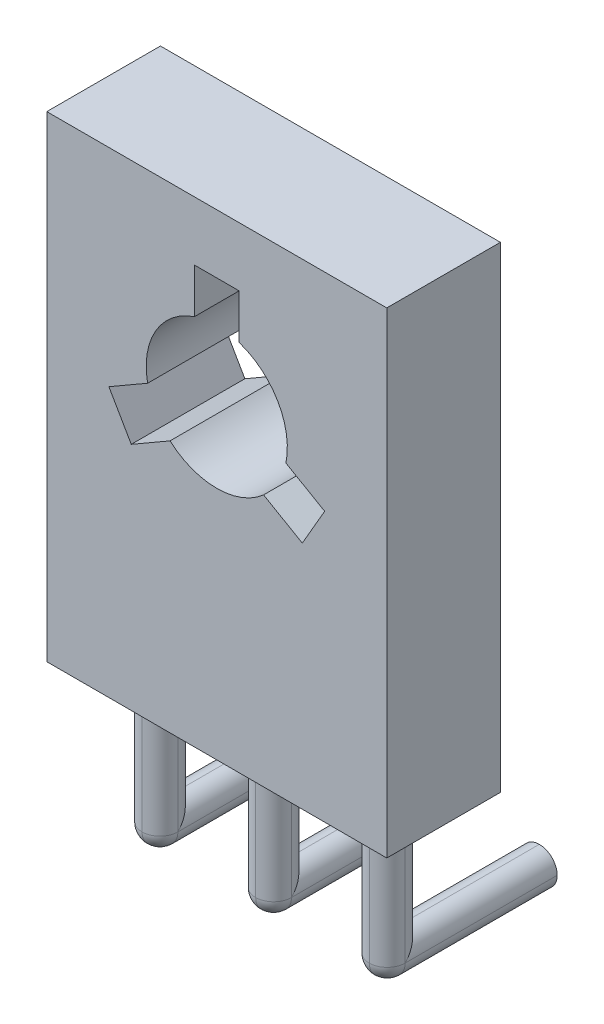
SolidWorks part; units mm, degrees
ref_plane "Face" through (0, 0, 0) normal (0, 0, 1) x (1, 0, 0)
ref_plane "Dessus" through (0, 0, 0) normal (0, 1, 0) x (1, 0, 0)
ref_plane "Droite" through (0, 0, 0) normal (1, 0, 0) x (0, 0, -1)
sketch "Esquisse1" plane through (0, 0, 0) normal (0, 0, 1) x (1, 0, 0)
  line L1 (-21.9012, 5.7776) -> (-14.3012, 5.7776)
  line L2 (-21.9012, 5.7776) -> (-21.9012, 16.4276)
  line L3 (-21.9012, 16.4276) -> (-14.3012, 16.4276)
  line L4 (-14.3012, 5.7776) -> (-14.3012, 16.4276)
  dimension "D1" = 10.65
  dimension "D2" = 7.6
extrude "Extrusion1" add sketch "Esquisse1" along normal blind 2.54
sketch "Esquisse2" plane through (0, 0, 2.54) normal (0, 0, 1) x (1, 0, 0)
  line L0 (-18.1012, 16.4276) -> (-18.1012, 5.7776) construction
  line L1 (-14.3012, 16.4276) -> (-21.9012, 16.4276) construction
  line L2 (-21.9012, 5.7776) -> (-14.3012, 5.7776) construction
  line L3 (-18.6012, 15.1075) -> (-17.6012, 15.1075)
  line L4 (-17.6012, 15.1075) -> (-17.6012, 14.1075)
  line L5 (-18.6012, 15.1075) -> (-18.6012, 14.1075)
  line L6 (-18.1012, 12.6114) -> (-21.1151, 10.8713) construction
  line L7 (-18.1012, 12.6114) -> (-15.5614, 11.145) construction
  line L8 (-20.5129, 11.7963) -> (-20.0129, 10.9303)
  line L9 (-16.1895, 10.9303) -> (-15.6895, 11.7963)
  line L10 (-20.0129, 10.9303) -> (-19.1469, 11.4303)
  line L11 (-20.5129, 11.7963) -> (-19.6469, 12.2963)
  line L12 (-16.1895, 10.9303) -> (-17.0555, 11.4303)
  line L13 (-15.6895, 11.7963) -> (-16.5555, 12.2963)
  arc A0 (-17.6012, 14.1075) -> (-16.5555, 12.2963) centre (-18.1012, 12.6114) cw
  arc A1 (-18.6012, 14.1075) -> (-19.6469, 12.2963) centre (-18.1012, 12.6114) ccw
  arc A2 (-19.1469, 11.4303) -> (-17.0555, 11.4303) centre (-18.1012, 12.6114) ccw
  dimension "D3" = 1
  dimension "D4" = 60
  dimension "D5" = 1
extrude "Enlèv. mat.-Extru.1" cut sketch "Esquisse2" against normal through all
sketch "Esquisse3" plane through (0, 5.7776, 0) normal (0, -1, 0) x (1, 0, 0)
  line L0 (-21.9012, 1.27) -> (-14.3012, 1.27) construction
  line L1 (-21.9012, 2.54) -> (-21.9012, 0) construction
  line L2 (-14.3012, 2.54) -> (-14.3012, 0) construction
  line L3 (-18.1012, 2.54) -> (-18.1012, 0) construction
  line L4 (-21.9012, 2.54) -> (-14.3012, 2.54) construction
  line L5 (-21.9012, 0) -> (-14.3012, 0) construction
  line L6 (-20.6412, 2.54) -> (-20.6412, 0) construction
  line L7 (-21.0412, 1.67) -> (-20.2412, 1.67)
  line L8 (-21.0412, 1.67) -> (-21.0412, 0.87)
  line L9 (-21.0412, 0.87) -> (-20.2412, 0.87)
  line L10 (-20.2412, 1.67) -> (-20.2412, 0.87)
  line L11 (-18.5012, 1.67) -> (-17.7012, 1.67)
  line L12 (-18.5012, 1.67) -> (-18.5012, 0.87)
  line L13 (-18.5012, 0.87) -> (-17.7012, 0.87)
  line L14 (-17.7012, 1.67) -> (-17.7012, 0.87)
  line L15 (-15.9612, 1.67) -> (-15.1612, 1.67)
  line L16 (-15.9612, 1.67) -> (-15.9612, 0.87)
  line L17 (-15.9612, 0.87) -> (-15.1612, 0.87)
  line L18 (-15.1612, 1.67) -> (-15.1612, 0.87)
  dimension "D3" = 0.8
extrude "Extrusion2" add sketch "Esquisse3" along normal blind 3.5
sketch "Esquisse4" plane through (0, 0, 0.87) normal (0, 0, -1) x (-1, 0, 0)
  line L0 (20.2412, 2.2776) -> (20.2412, 5.7776) construction
  line L1 (21.0412, 2.2776) -> (20.2412, 2.2776)
  line L2 (21.0412, 2.2776) -> (21.0412, 3.0776)
  line L3 (21.0412, 3.0776) -> (20.2412, 3.0776)
  line L4 (20.2412, 2.2776) -> (20.2412, 3.0776)
  line L5 (17.7012, 2.2776) -> (17.7012, 5.7776) construction
  line L6 (18.5012, 2.2776) -> (17.7012, 2.2776)
  line L7 (18.5012, 2.2776) -> (18.5012, 3.0776)
  line L8 (18.5012, 3.0776) -> (17.7012, 3.0776)
  line L9 (17.7012, 2.2776) -> (17.7012, 3.0776)
  line L10 (15.1612, 2.2776) -> (15.1612, 5.7776) construction
  line L11 (15.9612, 2.2776) -> (15.1612, 2.2776)
  line L12 (15.9612, 2.2776) -> (15.9612, 3.0776)
  line L13 (15.9612, 3.0776) -> (15.1612, 3.0776)
  line L14 (15.1612, 2.2776) -> (15.1612, 3.0776)
extrude "Extrusion3" add sketch "Esquisse4" along normal blind 3
fillet "Congé1" radius 0.4 54 edges at (-18.1012, 3.0776, 0.87) (-18.5012, 3.0776, -0.63) (-17.7012, 3.0776, -0.63) (-18.5012, 2.6776, -2.13) (-18.1012, 3.0776, -2.13) (-17.7012, 2.6776, -2.13) (-18.1012, 2.2776, -2.13) (-15.1612, 4.4276, 0.87) (-15.9612, 4.4276, 0.87) (-15.5612, 3.0776, 0.87) (-15.9612, 3.0776, -0.63) (-15.1612, 3.0776, -0.63) (-15.9612, 2.6776, -2.13) (-15.5612, 3.0776, -2.13) (-15.1612, 2.6776, -2.13) (-15.5612, 2.2776, -2.13) (-21.0412, 5.7776, 1.27) (-21.0412, 4.0276, 1.67) (-20.6412, 5.7776, 0.87) (-20.2412, 5.7776, 1.27) (-20.6412, 5.7776, 1.67) (-20.2412, 4.0276, 1.67) (-21.0412, 2.2776, -0.23) (-20.2412, 2.2776, -0.23) (-20.6412, 2.2776, 1.67) (-18.5012, 5.7776, 1.27) (-18.5012, 4.0276, 1.67) (-18.1012, 5.7776, 0.87) (-17.7012, 5.7776, 1.27) (-18.1012, 5.7776, 1.67) (-17.7012, 4.0276, 1.67) (-18.5012, 2.2776, -0.23) (-17.7012, 2.2776, -0.23) (-18.1012, 2.2776, 1.67) (-15.9612, 5.7776, 1.27) (-15.9612, 4.0276, 1.67) (-15.5612, 5.7776, 0.87) (-15.1612, 5.7776, 1.27) (-15.5612, 5.7776, 1.67) (-15.1612, 4.0276, 1.67) (-15.9612, 2.2776, -0.23) (-15.1612, 2.2776, -0.23) (-15.5612, 2.2776, 1.67) (-20.2412, 4.4276, 0.87) (-21.0412, 4.4276, 0.87) (-20.6412, 3.0776, 0.87) (-21.0412, 3.0776, -0.63) (-20.2412, 3.0776, -0.63) (-21.0412, 2.6776, -2.13) (-20.6412, 3.0776, -2.13) (-20.2412, 2.6776, -2.13) (-20.6412, 2.2776, -2.13) (-17.7012, 4.4276, 0.87) (-18.5012, 4.4276, 0.87)
